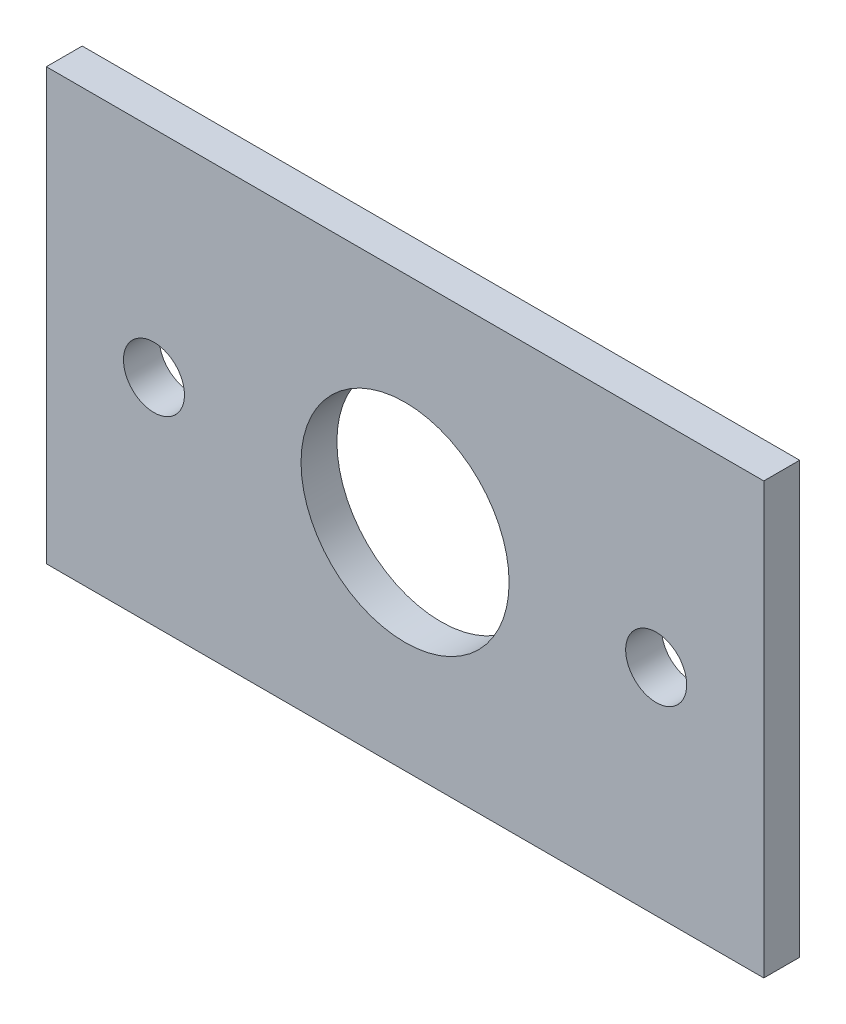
SolidWorks part; units mm, degrees
ref_plane "前视基准面" through (0, 0, 0) normal (0, 0, 1) x (1, 0, 0)
ref_plane "上视基准面" through (0, 0, 0) normal (0, 1, 0) x (1, 0, 0)
ref_plane "右视基准面" through (0, 0, 0) normal (1, 0, 0) x (0, 0, -1)
other "Configuration Table"
sketch "草图1" plane through (0, 0, 0) normal (0, 0, 1) x (1, 0, 0)
  line L1 (-20, -12) -> (20, -12)
  line L2 (-20, -12) -> (-20, 12)
  line L3 (-20, 12) -> (20, 12)
  line L4 (20, -12) -> (20, 12)
  circle A0 centre (0, 0) radius 5.8
  circle A1 centre (-14, 0) radius 1.7
  circle A2 centre (14, 0) radius 1.7
extrude "Bearing_retainer_40x24x2" add sketch "草图1" along normal blind 2
